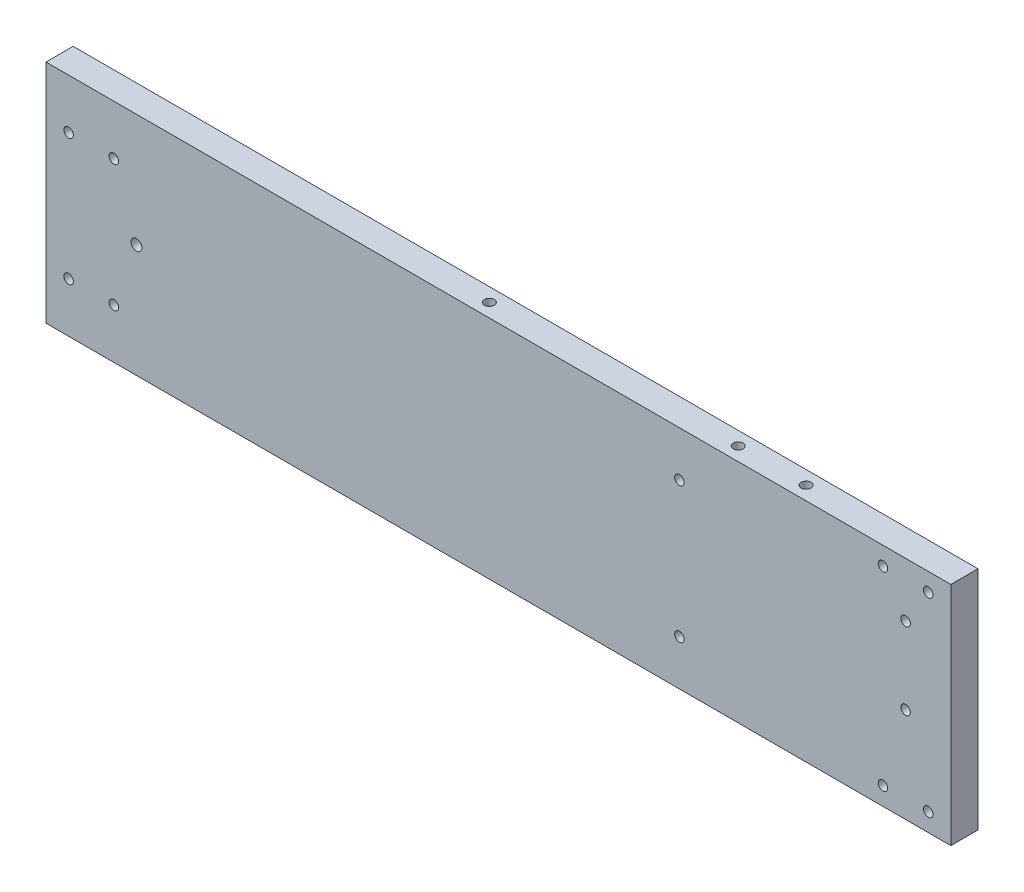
SolidWorks part; units mm, degrees
ref_plane "Plan de face" through (0, 0, 0) normal (0, 0, 1) x (1, 0, 0)
ref_plane "Plan de dessus" through (0, 0, 0) normal (0, 1, 0) x (1, 0, 0)
ref_plane "Plan de droite" through (0, 0, 0) normal (1, 0, 0) x (0, 0, -1)
sketch "Esquisse1" plane through (0, 0, 0) normal (0, 0, 1) x (1, 0, 0)
  line L0 (-210, 25) -> (12.1056, 25) construction
  line L1 (20.3751, -25) -> (-213.2339, -25) construction
  line L2 (0, 33.6481) -> (0, -42.324) construction
  line L3 (-200, 33.6481) -> (-200, -42.324) construction
  line L5 (-200, 25) -> (0, 25)
  line L6 (-200, 25) -> (-200, -25)
  line L7 (-200, -25) -> (0, -25)
  line L8 (0, 25) -> (0, -25)
extrude "Extrusion1" add sketch "Esquisse1" against normal blind 6
sketch "Esquisse2" plane through (0, 0, 0) normal (0, 0, 1) x (1, 0, 0)
  line L0 (10.4037, 0) -> (-213.9524, 0) construction
  line L1 (6.2636, 19.95) -> (-208.6293, 19.95) construction
  line L2 (-166, 32.1839) -> (-166, -43.3243) construction
  line L4 (-19.3659, 21) -> (4.8835, 21) construction
  line L5 (-5, 25) -> (-5, 19.95) construction
  line L6 (0, 25) -> (-200, 25) construction
  line L7 (-15, 22.45) -> (-15, 19.95) construction
  line L8 (-202.5169, 22) -> (-178.9969, 22) construction
  line L9 (-197, 26.8178) -> (-197, 20.95) construction
  line L10 (-183, 26.8178) -> (-183, 21) construction
  circle A3 centre (-5, 21) radius 1.05
  circle A4 centre (-15, 21) radius 1.05
  circle A5 centre (-197, 22) radius 1.05 construction
  circle A6 centre (-183, 22) radius 1.05 construction
  circle A7 centre (-5, -21) radius 1.05
  circle A8 centre (-15, -21) radius 1.05
  circle A12 centre (-197, -22) radius 1.05 construction
  circle A13 centre (-183, -22) radius 1.05 construction
  circle A14 centre (-195, 14) radius 1.05 construction
  circle A15 centre (-185, 14) radius 1.05 construction
  circle A16 centre (-195, -14) radius 1.05 construction
  circle A17 centre (-185, -14) radius 1.05 construction
extrude "Enlèv. mat.-Extru.1" cut sketch "Esquisse2" against normal blind 2
sketch "Esquisse3" plane through (0, 0, 0) normal (0, 0, 1) x (1, 0, 0)
  circle A0 centre (-60, 15) radius 1.05
  circle A1 centre (-60, -15) radius 1.05
extrude "Enlèv. mat.-Extru.2" cut sketch "Esquisse3" against normal blind 2
sketch "Esquisse4" plane through (0, 0, 0) normal (0, 0, 1) x (1, 0, 0)
  line L0 (-10, 27.8108) -> (-10, -3.6713) construction
  line L1 (-5.2707, 25) -> (3.1369, 25) construction
  line L2 (0, 25) -> (-200, 25) construction
  circle A0 centre (-10, 13) radius 1.05
  circle A1 centre (-10, -4) radius 1.05
extrude "Enlèv. mat.-Extru.3" cut sketch "Esquisse4" against normal blind 2
sketch "Esquisse5" plane through (0, -25, 0) normal (0, -1, 0) x (1, 0, 0)
  line L0 (3, -3.2551) -> (-122.8345, -3.2551) construction
  line L1 (0, 25.5751) -> (0, -38.4637) construction
  line L2 (-30, 18.4313) -> (-30, -30.0443) construction
  line L3 (-105, 18.4313) -> (-105, -30.0443) construction
  circle A0 centre (-30, -3.2551) radius 1.1
  circle A1 centre (-105, -3.2551) radius 1.1
  circle A2 centre (-50, -3.2551) radius 1.1
extrude "Enlèv. mat.-Extru.4" cut sketch "Esquisse5" against normal blind 3
sketch "Esquisse6" plane through (0, 25, 0) normal (0, 1, 0) x (-1, 0, 0)
  circle A0 centre (35, -3) radius 1.1
  circle A1 centre (105, -3) radius 1.1
  circle A2 centre (50, -3) radius 1.1
extrude "Enlèv. mat.-Extru.5" cut sketch "Esquisse6" against normal blind 3
sketch "Esquisse7" plane through (0, 0, 0) normal (0, 0, 1) x (1, 0, 0)
  line L0 (-205.3637, 0) -> (-102.444, 0) construction
  circle A0 centre (-197, 22) radius 1.05 construction
  circle A1 centre (-183, 22) radius 1.05 construction
  circle A2 centre (-195, 14) radius 1.05
  circle A3 centre (-185, 14) radius 1.05
  circle A4 centre (-185, -14) radius 1.05
  circle A5 centre (-195, -14) radius 1.05
  circle A6 centre (-197, -22) radius 1.05 construction
  circle A7 centre (-183, -22) radius 1.05 construction
extrude "Enlèv. mat.-Extru.6" cut sketch "Esquisse7" against normal through all
sketch "Esquisse8" plane through (0, 0, 0) normal (0, 0, 1) x (1, 0, 0)
  circle A0 centre (-180, 0) radius 1.2
extrude "Enlèv. mat.-Extru.7" cut sketch "Esquisse8" against normal blind 2
